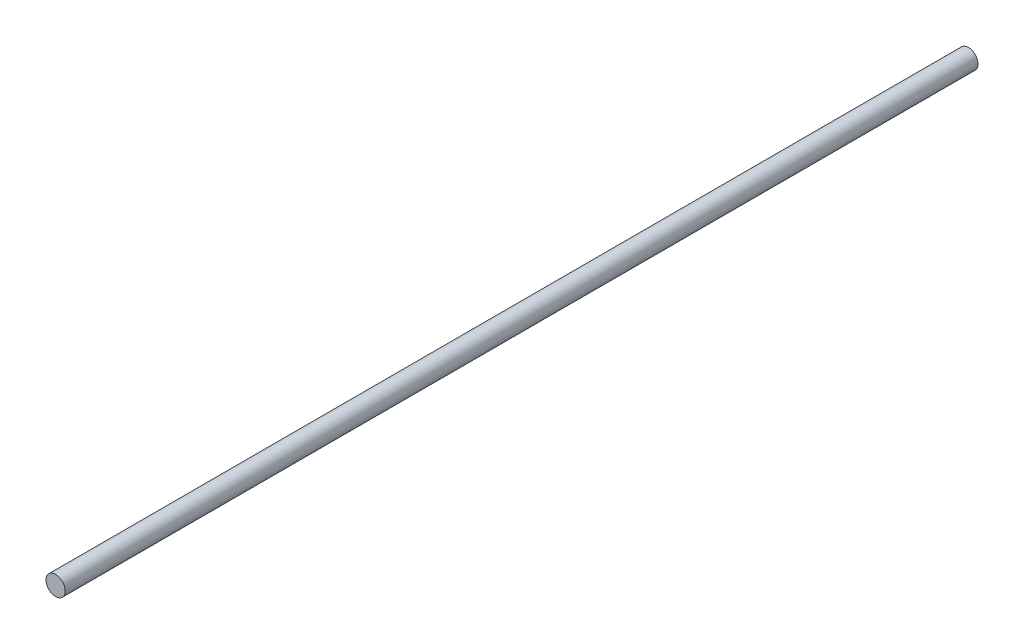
SolidWorks part; units mm, degrees
ref_plane "Front Plane" through (0, 0, 0) normal (0, 0, 1) x (1, 0, 0)
ref_plane "Top Plane" through (0, 0, 0) normal (0, 1, 0) x (1, 0, 0)
ref_plane "Right Plane" through (0, 0, 0) normal (1, 0, 0) x (0, 0, -1)
sketch "Sketch1" plane through (0, 0, 0) normal (0, 0, 1) x (1, 0, 0)
  circle A0 centre (0, 0) radius 30
  dimension "D1" = 60
extrude "Boss-Extrude1" add sketch "Sketch1" against normal blind 2850
